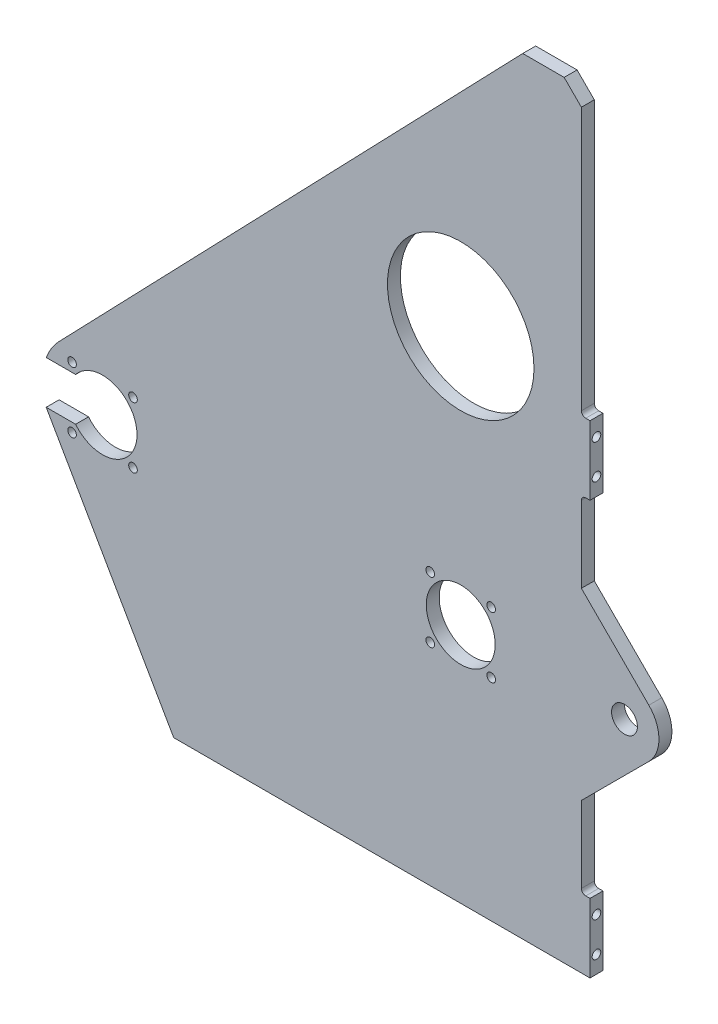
SolidWorks part; units mm, degrees
ref_plane "Face" through (0, 0, 0) normal (0, 0, 1) x (1, 0, 0)
ref_plane "Dessus" through (0, 0, 0) normal (0, 1, 0) x (1, 0, 0)
ref_plane "Droite" through (0, 0, 0) normal (1, 0, 0) x (0, 0, -1)
sketch "Esquisse1" plane through (0, 0, 0) normal (0, 0, 1) x (1, 0, 0)
  line L0 (0, 328.977) -> (0, -383.7501) construction
  line L1 (549.6503, 0) -> (-278.9252, 0) construction
  line L2 (-333.06, -280) -> (150, -280)
  line L3 (150, -280) -> (150, -200)
  line L4 (140, -195) -> (140, -106.5685)
  line L5 (145, -200) -> (150, -200)
  line L6 (190, 65.0158) -> (190, -83.2554) construction
  line L7 (218.2843, -28.2843) -> (140, -106.5685)
  line L8 (140, 106.5685) -> (218.2843, 28.2843)
  line L9 (140, 106.5685) -> (140, 195)
  line L10 (150, 200) -> (150, 280)
  line L11 (145, 200) -> (150, 200)
  line L12 (140, 285) -> (140, 610)
  line L13 (145, 280) -> (150, 280)
  line L14 (140, 610) -> (71.95, 610)
  line L15 (-415.62, 53.01) -> (-415.62, -576.2947) construction
  line L16 (-567.8485, 3.01) -> (-333.06, 3.01) construction
  line L17 (-481.005, -21.99) -> (-446.845, -21.99)
  line L18 (-481.0035, 28.01) -> (-446.845, 28.01)
  line L19 (-481.005, -21.99) -> (-333.06, -280)
  line L20 (71.95, 610) -> (-466.0316, 51.5762)
  line L21 (-123.733, 300) -> (50.4978, 300) construction
  circle A0 centre (0, 0) radius 40
  arc A1 (145, -200) -> (140, -195) centre (145, -195) cw
  circle A2 centre (190, 0) radius 15
  arc A3 (218.2843, -28.2843) -> (218.2843, 28.2843) centre (190, 0) ccw
  arc A4 (145, 200) -> (140, 195) centre (145, 195) ccw
  arc A5 (145, 280) -> (140, 285) centre (145, 285) cw
  arc A6 (-446.845, -21.99) -> (-446.845, 28.01) centre (-415.62, 3.01) ccw
  circle A7 centre (-415.62, 3.01) radius 50 construction
  arc A8 (-466.0316, 51.5762) -> (-481.0035, 28.01) centre (-415.62, 3.01) ccw
  circle A9 centre (0, 300) radius 85
  point P26 (140, 200)
  dimension "D1" = 80
  dimension "D7" = 5
  dimension "D9" = 30
  dimension "D10" = 80
  dimension "D14" = 5
  dimension "D16" = 5
  dimension "D21" = 80
  dimension "D22" = 100
  dimension "D23" = 25
  dimension "D27" = 140
  dimension "D30" = 170
  dimension "D2" = 280
  dimension "D3" = 150
  dimension "D4" = 333.06
  dimension "D5" = 80
  dimension "D6" = 10
  dimension "D8" = 40
  dimension "D11" = 90
  dimension "D12" = 45
  dimension "D13" = 400
  dimension "D15" = 80
  dimension "D17" = 890
  dimension "D18" = 68.05
  dimension "D19" = 10
  dimension "D20" = 283.01
  dimension "D24" = 25
  dimension "D25" = 580
  dimension "D26" = 34.16
  dimension "D28" = 565.62
  dimension "D29" = 10
extrude "Base-Extrusion" add sketch "Esquisse1" along normal blind 15
chamfer "Chanfrein1" distance 20 angle 45 1 edges at (140, 610, 7.5)
sketch "Esquisse2" plane through (0, 0, 15) normal (0, 0, 1) x (1, 0, 0)
  line L0 (0, 127.8206) -> (0, -161.2192) construction
  line L1 (-117.7068, 0) -> (149.7449, 0) construction
  line L2 (-125.1194, -125.1194) -> (102.5033, 102.5033) construction
  line L3 (-75.5508, 75.5508) -> (96.7866, -96.7866) construction
  line L4 (-510.2818, 3.01) -> (-320.9582, 3.01) construction
  line L5 (-333.06, -280) -> (150, -280) construction
  line L6 (-415.62, 127.8206) -> (-415.62, -161.2192) construction
  line L7 (150, -280) -> (150, -200) construction
  line L8 (-495.2015, -76.5715) -> (-336.0385, 82.5915) construction
  line L9 (-487.2107, 74.6007) -> (-344.0293, -68.5807) construction
  circle A0 centre (0, 0) radius 50 construction
  circle A1 centre (-415.62, 3.01) radius 50 construction
  dimension "D1" = 100
  dimension "D6" = 100
  dimension "D2" = 45
  dimension "D3" = 45
  dimension "D4" = 283.01
  dimension "D5" = 565.62
  dimension "D7" = 45
  dimension "D8" = 45
hole_wizard "Trou taraudé M10x1.51" positions "Esquisse3D1" profile "Esquisse3" tap size "M10x1.5" standard "ISO"
sketch3d "Esquisse3D1"
  line L0 (-75.5508, 75.5508, 15) -> (96.7866, -96.7866, 15) construction
  line L1 (-125.1194, -125.1194, 15) -> (102.5033, 102.5033, 15) construction
  circle A0 centre (0, 0, 15) radius 50 construction
  point P0 (-35.3553, 35.3553, 15)
  point P1 (-35.3553, -35.3553, 15)
  point P2 (35.3553, -35.3553, 15)
  point P3 (35.3553, 35.3553, 15)
  point P8 (0, 0, 65)
sketch "Esquisse3" plane through (-35.3553, 35.3553, 15) normal (1, 0, 0) x (0, -1, 0)
  line L0 (0, 0) -> (0, 15)
  line L1 (0, 15) -> (4.25, 15)
  line L3 (4.25, 15) -> (4.25, 20)
  line L4 (4.25, 20) -> (5, 20)
  line L5 (5, 20) -> (5, 0)
  line L7 (5, 0) -> (0, 0)
  line L11 (0, -6.35) -> (0, 107.95) construction
  dimension "Diamètre du trou pour taraudage jusqu'au prochain" = 8.5
  dimension "Profondeur du trou pour taraudage jusqu'au prochain" = 15
  dimension "Diamètre du filetage" = 10
  dimension "Profondeur du filetage" = 20
hole_wizard "Trou taraudé M10x1.52" positions "Esquisse3D2" profile "Esquisse5" tap size "M10x1.5" standard "ISO"
sketch3d "Esquisse3D2"
  line L0 (-495.2015, -76.5715, 15) -> (-336.0385, 82.5915, 15) construction
  line L1 (-487.2107, 74.6007, 15) -> (-344.0293, -68.5807, 15) construction
  circle A0 centre (-415.62, 3.01, 15) radius 50 construction
  point P0 (-380.2647, 38.3653, 15)
  point P1 (-380.2647, -32.3453, 15)
  point P2 (-450.9753, -32.3453, 15)
  point P3 (-450.9753, 38.3653, 15)
  point P8 (-415.62, 3.01, 65)
sketch "Esquisse5" plane through (-380.2647, 38.3653, 15) normal (1, 0, 0) x (0, -1, 0)
  line L0 (0, 0) -> (0, 15)
  line L1 (0, 15) -> (4.25, 15)
  line L3 (4.25, 15) -> (4.25, 20)
  line L4 (4.25, 20) -> (5, 20)
  line L5 (5, 20) -> (5, 0)
  line L7 (5, 0) -> (0, 0)
  line L11 (0, -6.35) -> (0, 107.95) construction
  dimension "Diamètre du trou pour taraudage jusqu'au prochain" = 8.5
  dimension "Profondeur du trou pour taraudage jusqu'au prochain" = 15
  dimension "Diamètre du filetage" = 10
  dimension "Profondeur du filetage" = 20
sketch "Esquisse6" plane through (150, 0, 0) normal (1, 0, 0) x (0, 0, -1)
  line L0 (-52.9826, -260) -> (64.4625, -260) construction
  line L1 (-15, -280) -> (0, -280) construction
  line L2 (-52.9826, -220) -> (57.5339, -220) construction
  line L3 (-124.4203, 220) -> (82.2517, 220) construction
  line L4 (-124.4203, 260) -> (82.2517, 260) construction
  line L5 (-15, 200) -> (0, 200) construction
  line L6 (-7.5, 385.3026) -> (-7.5, -287.4931) construction
  line L9 (0, 285) -> (0, 590) construction
  dimension "D1" = 20
  dimension "D2" = 40
  dimension "D3" = 20
  dimension "D4" = 40
  dimension "D5" = 7.5
hole_wizard "Trou taraudé M10x1.53" positions "Esquisse3D3" profile "Esquisse7" tap size "M10x1.5" standard "ISO"
sketch3d "Esquisse3D3"
  line L0 (150, 260, 124.4203) -> (150, 260, -82.2517) construction
  line L1 (150, 385.3026, 7.5) -> (150, -287.4931, 7.5) construction
  line L2 (150, 220, 124.4203) -> (150, 220, -82.2517) construction
  line L3 (150, -220, 52.9826) -> (150, -220, -57.5339) construction
  line L4 (150, -260, 52.9826) -> (150, -260, -64.4625) construction
  point P0 (150, -260, 7.5)
  point P1 (150, -220, 7.5)
  point P2 (150, 220, 7.5)
  point P3 (150, 260, 7.5)
sketch "Esquisse7" plane through (150, -260, 7.5) normal (0, 1, 0) x (0, 0, -1)
  line L0 (0, 0) -> (0, 21.0537)
  line L1 (0, 21.0537) -> (4.25, 18.5)
  line L2 (4.25, 18.5) -> (4.25, 20)
  line L3 (4.25, 20) -> (5, 20)
  line L4 (5, 20) -> (5, 0)
  line L5 (5, 0) -> (0, 0)
  line L10 (0, 21.0537) -> (-4.25, 18.5) construction
  line L11 (0, -6.35) -> (0, 107.95) construction
  dimension "Diamètre du trou pour taraudage" = 8.5
  dimension "Profondeur du trou pour taraudage" = 18.5
  dimension "Diamètre du filetage" = 10
  dimension "Profondeur du filetage" = 20
  dimension "Angle de pointe" = 118
sketch "Esquisse8" plane through (0, 0, 15) normal (0, 0, 1) x (1, 0, 0)
  line L0 (-407.0325, -254.9747) -> (-153.2122, -126.8175)
  line L1 (-153.2122, -126.8175) -> (-80.3189, 105.4407)
  line L2 (-80.3189, 105.4407) -> (78.8563, 75.8095)
  line L3 (78.8563, 75.8095) -> (151.5942, 300.9506)
extrude "Enlèv. mat.-Extru.1" cut sketch "Esquisse8" against normal through all and the other way through all
